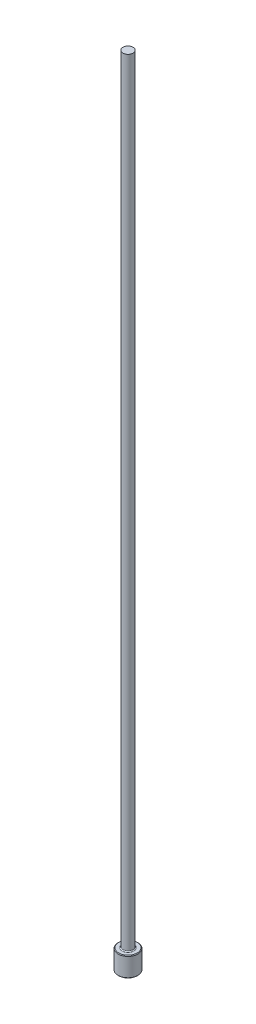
SolidWorks part; units mm, degrees
ref_plane "Front Plane" through (0, 0, 0) normal (0, 0, 1) x (1, 0, 0)
ref_plane "Top Plane" through (0, 0, 0) normal (0, 1, 0) x (1, 0, 0)
ref_plane "Right Plane" through (0, 0, 0) normal (1, 0, 0) x (0, 0, -1)
other "Configuration Table"
sketch "Sketch1" plane through (0, 0, 0) normal (0, 0, 1) x (1, 0, 0)
  line L0 (0, 259.9588) -> (0, -15.1925) construction
  line L1 (0, 0) -> (-0.7874, 0)
  line L2 (-0.7874, 0) -> (-0.7874, 1.5748)
  line L3 (-0.7874, 1.5748) -> (-0.4064, 1.5748)
  line L4 (-0.4064, 1.5748) -> (-0.4064, 63.5)
  line L5 (-0.4064, 63.5) -> (0, 63.5)
  line L6 (0, 63.5) -> (0, 0)
  dimension "L" = 63.5
  dimension "H" = 1.5748
  dimension "T" = 1.5748
  dimension "D" = 0.8128
revolve "Revolve1" add sketch "Sketch1" angle 360 about L0
chamfer "Chamfer1" distance 0.0508 angle 45 2 edges at (0, 1.5748, 0.7874) (0, 0, 0.7874)
fillet "Fillet1" radius 0.0762 1 edges at (0, 1.5748, 0.4064)
